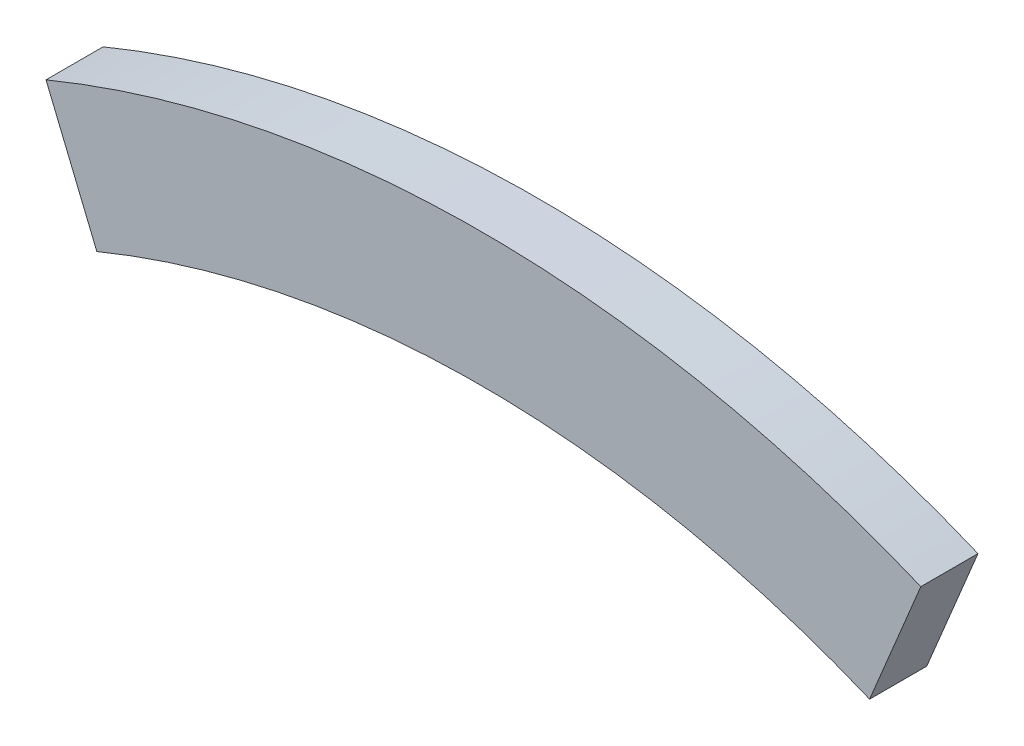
SolidWorks part; units mm, degrees
ref_plane "Front Plane" through (0, 0, 0) normal (0, 0, 1) x (1, 0, 0)
ref_plane "Top Plane" through (0, 0, 0) normal (0, 1, 0) x (1, 0, 0)
ref_plane "Right Plane" through (0, 0, 0) normal (1, 0, 0) x (0, 0, -1)
sketch "Sketch2" plane through (0, 0, 0) normal (0, 0, 1) x (1, 0, 0)
  line L0 (0, 0) -> (-33.881, 82.1906)
  line L1 (515.1677, -0.8752) -> (549.3277, 81.1998)
  line L2 (-33.881, 139.7) -> (549.3277, 139.7) construction
  line L3 (-33.881, 139.7) -> (-33.881, 0) construction
  line L4 (-33.881, 0) -> (549.3277, 0) construction
  line L5 (549.3277, 0) -> (549.3277, 139.7) construction
  arc A0 (0, 0) -> (515.1677, -0.8752) centre (256.5274, -622.3) cw
  arc A1 (-33.881, 82.1906) -> (549.3277, 81.1998) centre (256.5274, -622.3) cw
  dimension "D1" = 673.1
  dimension "D2" = 762
  dimension "D6" = 88.9
  dimension "D3" = 139.7
  dimension "D4" = 45
  dimension "D5" = 583.2087
extrude "Boss-Extrude1" add sketch "Sketch2" along normal blind 38.1
